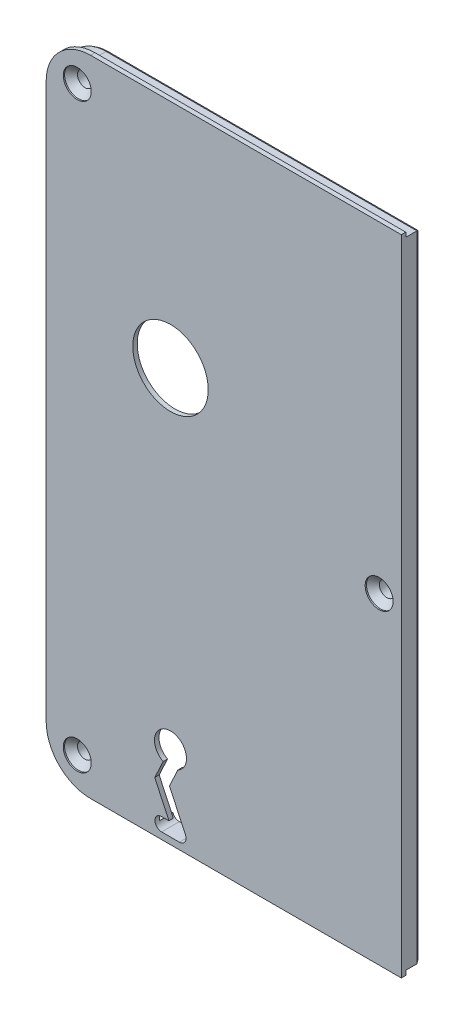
SolidWorks part; units mm, degrees
ref_plane "Ebene vorne" through (0, 0, 0) normal (0, 0, 1) x (1, 0, 0)
ref_plane "Ebene oben" through (0, 0, 0) normal (0, 1, 0) x (1, 0, 0)
ref_plane "Ebene rechts" through (0, 0, 0) normal (1, 0, 0) x (0, 0, -1)
sketch "Skizze1" plane through (0, 0, 0) normal (0, 0, 1) x (1, 0, 0)
  line L0 (0, -72.5) -> (0, 72.5)
  line L1 (6.651, 0) -> (-87.213, 0) construction
  line L5 (0, 72.5) -> (-70, 72.5)
  line L6 (0, -72.5) -> (-70, -72.5)
  line L7 (-80, 62.5) -> (-80, -62.5)
  arc A0 (-70, 72.5) -> (-80, 62.5) centre (-70, 62.5) ccw
  arc A1 (-80, -62.5) -> (-70, -72.5) centre (-70, -62.5) ccw
  dimension "D3" = 10
  dimension "D1" = 80
  dimension "D2" = 145
extrude "Linear austragen1" add sketch "Skizze1" against normal blind 1
sketch "Bohrpositionen" plane through (0, 0, 0) normal (0, 0, 1) x (1, 0, 0)
  line L4 (0, -72.5) -> (0, 72.5) construction
  line L5 (-80, 62.5) -> (-80, -62.5) construction
  line L6 (0, 72.5) -> (-70, 72.5) construction
  line L7 (-70, -72.5) -> (0, -72.5) construction
  point P0 (-73, 65.5)
  point P1 (-73, -65.5)
  point P2 (-5, 0)
  dimension "D1" = 5
  dimension "D2" = 7
  dimension "D3" = 7
  dimension "D4" = 7
  dimension "D5" = 7
sketch "Skizze9" plane through (0, 0, -1) normal (0, 0, -1) x (-1, 0, 0)
  line L0 (70, 71.5) -> (0, 71.5)
  line L1 (0, -72.5) -> (0, 72.5) construction
  line L2 (1.5, 70) -> (1.5, 5)
  line L3 (1.5, -70) -> (69, -70)
  line L4 (69, -70) -> (69, -61.5)
  line L5 (0, 71.5) -> (0, -71.5)
  line L6 (0, -71.5) -> (70, -71.5)
  line L7 (1.5, 5) -> (10, 5)
  line L8 (10, 5) -> (10, -5)
  line L9 (79, -62.5) -> (79, 62.5)
  line L10 (10, -5) -> (1.5, -5)
  line L11 (1.5, -5) -> (1.5, -70)
  line L12 (-3.7821, 0) -> (82.5961, 0) construction
  line L13 (69, -61.5) -> (77.5, -61.5)
  line L17 (77.5, -61.5) -> (77.5, 61.5)
  line L18 (77.5, 61.5) -> (69, 61.5)
  line L19 (69, 61.5) -> (69, 70)
  line L20 (69, 70) -> (1.5, 70)
  arc A0 (79, -62.5) -> (70, -71.5) centre (70, -62.5) cw
  arc A1 (70, 71.5) -> (79, 62.5) centre (70, 62.5) cw
  dimension "D4" = 76
  dimension "D5" = 1.5
  dimension "D8" = 10
  dimension "D1" = 140
  dimension "D2" = 143
  dimension "D3" = 79
  dimension "D6" = 8.5
  dimension "D7" = 8.5
  dimension "D9" = 10
extrude "Halterand" add sketch "Skizze9" along normal blind 3
hole_wizard "Formsenkung für M3 Senkschraube mit Schlitz/Kreuzschlitz1" positions "3D-Skizze1" profile "Skizze11" countersink size "M3" standard "DIN"
sketch3d "3D-Skizze1"
  point P0 (-73, 65.5, 0)
  point P3 (-5, 0, 0)
  point P6 (-73, -65.5, 0)
sketch "Skizze11" plane through (-73, 65.5, 0) normal (1, 0, 0) x (0, -1, 0)
  line L0 (0, 0) -> (0, 4)
  line L1 (0, 4) -> (1.725, 4)
  line L3 (1.7, 1.75) -> (3.15, 0.3)
  line L4 (3.15, 0.3) -> (3.15, 0)
  line L6 (3.15, 0) -> (0, 0)
  line L7 (-1.7, 1.75) -> (-3.15, 0.3) construction
  line L8 (1.725, 4) -> (1.7, 3.975)
  line L9 (1.7, 3.975) -> (1.7, 1.75)
  line L10 (-1.725, 4) -> (-1.7, 3.975) construction
  line L11 (0, -6.35) -> (0, 107.95) construction
  dimension "Bohrerdurchmesser" = 3.4
  dimension "Bohrungstiefe" = 4
  dimension "Senkdurchmesser2" = 6.3
  dimension "Senkwinkel2" = 90
  dimension "Senkdurchmesser2 (Unten)" = 3.45
  dimension "Senkwinkel2 (Unten)" = 90
  dimension "Kopfspielraum" = 0.3
chamfer "Fase1" distance 0.5 angle 30 6 edges at (-35, 71.5, -4) (-76.364, 68.864, -4) (0, 0, -4) (-35, -71.5, -4) (-76.364, -68.864, -4) (-79, 0, -4)
sketch "Skizze12" plane through (0, 0, 0) normal (0, 0, -1) x (-1, 0, 0)
  line L0 (50.3449, -57.097) -> (52.2367, -61.154)
  line L1 (52.2367, -61.154) -> (48.6405, -68.8661)
  line L2 (53.6551, -57.097) -> (55.5469, -61.154)
  line L3 (55.5469, -61.154) -> (52.3545, -68)
  line L4 (52.3545, -68) -> (54, -68)
  line L5 (50, -71) -> (54, -71)
  line L6 (52, -35.7522) -> (52, -60.9208) construction
  line L7 (46.6751, -57.5) -> (53.4409, -57.5) construction
  line L10 (80, 62.5) -> (80, -62.5) construction
  line L11 (70, -72.5) -> (0, -72.5) construction
  arc A0 (50.3449, -57.097) -> (53.6551, -57.097) centre (52, -53.9) cw
  arc A2 (48.6405, -68.8661) -> (50, -71) centre (50, -69.5) ccw
  arc A3 (54, -68) -> (54, -71) centre (54, -69.5) cw
  dimension "D1" = 3
  dimension "D2" = 3
  dimension "D3" = 3
  dimension "D4" = 4
  dimension "D5" = 130
  dimension "D6" = 13.5
  dimension "D7" = 28
  dimension "D8" = 3.6
  dimension "D9" = 15
  dimension "D10" = 1.5
extrude "Austrag für Schlüsselloch" cut sketch "Skizze12" along normal up to next
sketch "Skizze13" plane through (0, 0, 0) normal (0, 0, 1) x (1, 0, 0)
  line L0 (-68.2744, 20.5) -> (-30.9955, 20.5) construction
  line L1 (-52, 43.739) -> (-52, 3.6041) construction
  line L2 (-70, -72.5) -> (0, -72.5) construction
  circle A0 centre (-52, 20.5) radius 8.5
  dimension "D3" = 17
  dimension "D1" = 52
  dimension "D2" = 93
extrude "Austrag für  Nuss" cut sketch "Skizze13" against normal up to next
